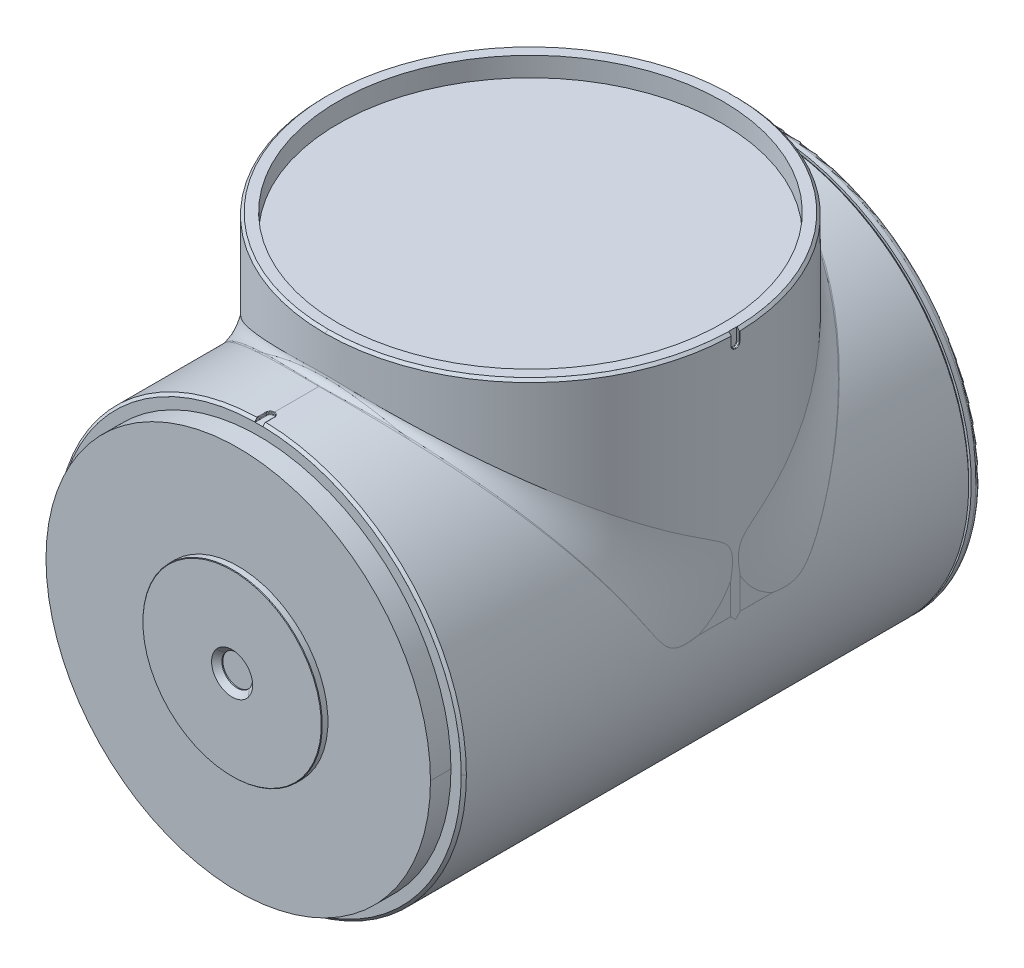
SolidWorks part; units mm, degrees
other "<4.0.07.2008582>-<输入1>"
ref_plane "前视基准面" through (0, 0, 0) normal (0, 0, 1) x (1, 0, 0)
ref_plane "上视基准面" through (0, 0, 0) normal (0, 1, 0) x (1, 0, 0)
ref_plane "右视基准面" through (0, 0, 0) normal (1, 0, 0) x (0, 0, -1)
imported_body "FR5-V6.0-922-6-1-solid1"
imported_body "FR5-V6.0-922-14关节后盖-1-solid1"
other "删除面1"
ref_plane "前视基准面-4.0.07.2008582" through (-794.569, 24.5293, 53.85) normal (-1, 0, 0) x (0, 0, 1)
ref_plane "上视基准面-4.0.07.2008582" through (-794.569, 24.5293, 53.85) normal (0, 1, 0) x (0, 0, 1)
ref_plane "右视基准面-4.0.07.2008582" through (-794.569, 24.5293, 53.85) normal (0, 0, 1) x (1, 0, 0)
inserted part "4.0.07.2008582"
move or copy body "实体-移动/复制2"
pattern_circular "阵列(圆周)1" count 4 over 360 about axis through (-820.01, 50, 0) along (0, 0, 1)
